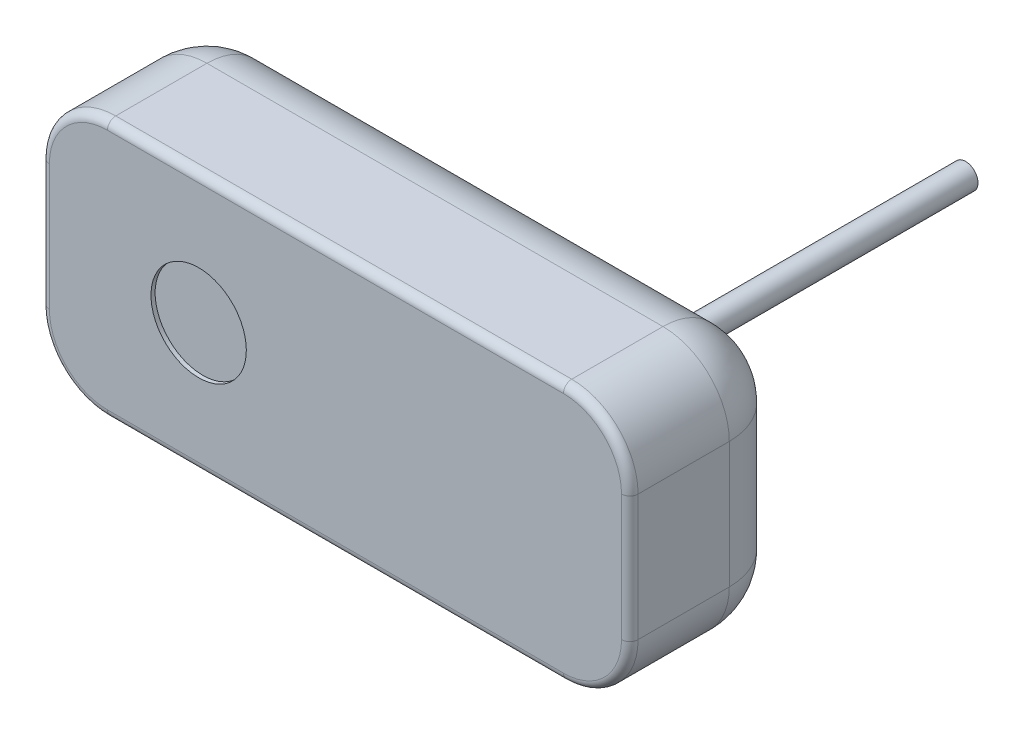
SolidWorks part; units mm, degrees
ref_plane "前视基准面" through (0, 0, 0) normal (0, 0, 1) x (1, 0, 0)
ref_plane "上视基准面" through (0, 0, 0) normal (0, 1, 0) x (1, 0, 0)
ref_plane "右视基准面" through (0, 0, 0) normal (1, 0, 0) x (0, 0, -1)
sketch "草图1" plane through (0, 0, 0) normal (0, 0, 1) x (1, 0, 0)
  line L1 (-35.5, -15.6) -> (35.5, -15.6)
  line L2 (-35.5, -15.6) -> (-35.5, 15.6)
  line L3 (-35.5, 15.6) -> (35.5, 15.6)
  line L4 (35.5, -15.6) -> (35.5, 15.6)
  line L5 (-35.5, -15.6) -> (35.5, 15.6) construction
  line L6 (-35.5, 15.6) -> (35.5, -15.6) construction
  point P0 (0, 0)
  dimension "D1" = 31.2
  dimension "D2" = 71
extrude "凸台-拉伸1" add sketch "草图1" along normal blind 20 contours L3 L4 L1 L2
fillet "圆角1" radius 8 4 edges at (-35.5, -15.6, 10) (35.5, -15.6, 10) (35.5, 15.6, 10) (-35.5, 15.6, 10)
fillet "圆角2" radius 8 8 edges at (-33.1569, 13.2569, 0) (-35.5, 0, 0) (-33.1569, -13.2569, 0) (0, -15.6, 0) (33.1569, -13.2569, 0) (35.5, 0, 0) (33.1569, 13.2569, 0) (0, 15.6, 0)
fillet "圆角3" radius 1 8 edges at (-33.1569, 13.2569, 20) (-35.5, 0, 20) (-33.1569, -13.2569, 20) (0, -15.6, 20) (33.1569, -13.2569, 20) (35.5, 0, 20) (33.1569, 13.2569, 20) (0, 15.6, 20)
sketch "草图2" plane through (0, 0, 20) normal (0, 0, 1) x (1, 0, 0)
  line L1 (-35.5, -7.6) -> (-35.5, 7.6) construction
  circle A0 centre (-16.5, 0) radius 5.75
  dimension "D2" = 11.5
  dimension "D1" = 19
extrude "切除-拉伸1" cut sketch "草图2" against normal blind 0.5
ref_plane "基准面1" through (-10, 0, 0) normal (1, 0, 0) x (0, 0, -1)
sketch "草图3" plane through (-10, 0, 0) normal (1, 0, 0) x (0, 0, -1)
  line L0 (0, 0) -> (7.7352, 0) construction
  line L1 (0, 7.6) -> (0, -7.6) construction
  line L3 (0, 3) -> (3.5, 3)
  line L4 (0, 3) -> (0, -3)
  line L5 (0, -3) -> (3.5, -3)
  arc A0 (3.5, -3) -> (3.5, 3) centre (3.5, 0) ccw
  dimension "D2" = 3
  dimension "D1" = 3.5
extrude "凸台-拉伸2" add sketch "草图3" along normal mid plane 7
sketch "草图4" plane through (0, 0, 0) normal (0, 0, -1) x (-1, 0, 0)
  line L1 (-35.5, -7.6) -> (-35.5, 7.6) construction
  line L2 (-27.5, 15.6) -> (27.5, 15.6) construction
  circle A0 centre (-23, 8.6) radius 1.5
  dimension "D1" = 7
  dimension "D2" = 3
  dimension "D3" = 12.5
extrude "凸台-拉伸3" add sketch "草图4" along normal blind 33 and the other way up to next
